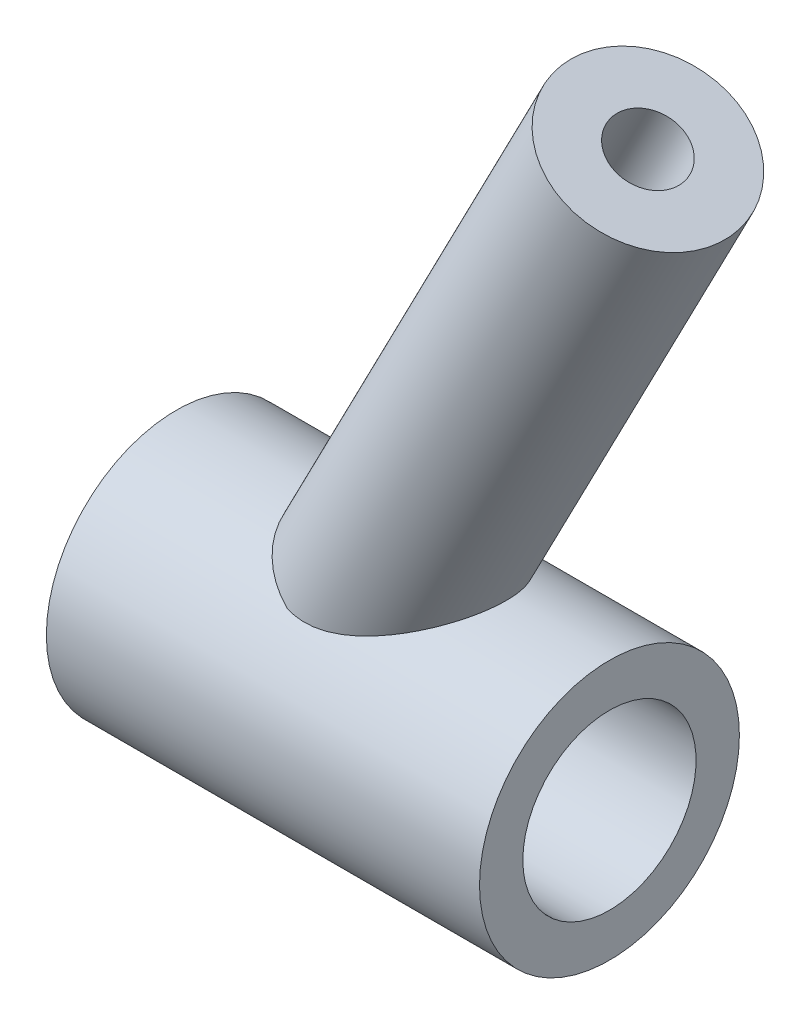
SolidWorks part; units mm, degrees
ref_plane "Face" through (0, 0, 0) normal (0, 0, 1) x (1, 0, 0)
ref_plane "Dessus" through (0, 0, 0) normal (0, 1, 0) x (1, 0, 0)
ref_plane "Droite" through (0, 0, 0) normal (1, 0, 0) x (0, 0, -1)
sketch "Esquisse1" plane through (0, 0, 0) normal (0, 0, 1) x (1, 0, 0)
  line L0 (0, 0) -> (5, 0) construction
  line L1 (0, 1) -> (0, 1.5)
  line L2 (0, 1.5) -> (5, 1.5)
  line L3 (5, 1.5) -> (5, 1)
  line L4 (5, 1) -> (0, 1)
  dimension "D1" = 1
  dimension "D2" = 1.5
  dimension "D3" = 5
revolve "Révolution1" add sketch "Esquisse1" angle 360 about L0
sketch "Esquisse2" plane through (0, 0, 0) normal (0, 0, 1) x (1, 0, 0)
  line L0 (5, 1.5) -> (5, 7.0592) construction
  line L2 (1.5551, 1.5) -> (4.5561, 7.2893)
  line L3 (5, 1.5) -> (0, 1.5) construction
  line L4 (4.5561, 7.2893) -> (5.4439, 6.8291)
  line L5 (5.4439, 6.8291) -> (2.4429, 1.0398)
  line L6 (2.4429, 1.0398) -> (1.5551, 1.5)
  dimension "D1" = 9.9
  dimension "D3" = 1
revolve "Révolution2" add sketch "Esquisse2" angle 360 about L5
sketch "Esquisse3" plane through (3.9432, 7.607, 0) normal (0.4602, 0.8878, 0) x (0.8878, -0.4602, 0)
  circle A0 centre (1.6903, 0) radius 0.4
  dimension "D1" = 0.8
extrude "Extrusion1" cut sketch "Esquisse3" against normal blind 6.5
